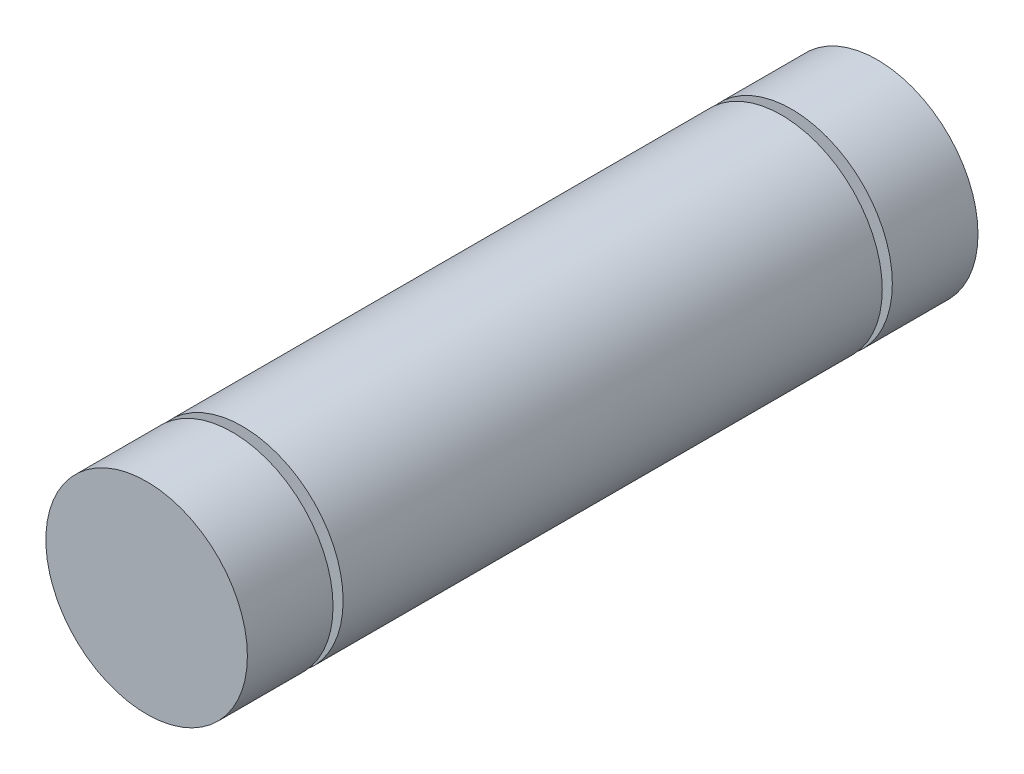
SolidWorks part; units mm, degrees
ref_plane "Plan de face" through (0, 0, 0) normal (0, 0, 1) x (1, 0, 0)
ref_plane "Plan de dessus" through (0, 0, 0) normal (0, 1, 0) x (1, 0, 0)
ref_plane "Plan de droite" through (0, 0, 0) normal (1, 0, 0) x (0, 0, -1)
sketch "Esquisse1" plane through (0, 0, 0) normal (0, 0, 1) x (1, 0, 0)
  circle A0 centre (0, 0) radius 20
  dimension "D1" = 40
extrude "Boss.-Extru.1" add sketch "Esquisse1" along normal blind 145
sketch "Esquisse2" plane through (0, 0, 0) normal (0, 1, 0) x (1, 0, 0)
  line L0 (20, -145) -> (20, 0) construction
  line L1 (20, -19) -> (17, -19)
  line L2 (20, -19) -> (20, -17)
  line L3 (20, -17) -> (17, -17)
  line L4 (17, -19) -> (17, -17)
  line L6 (20, -126) -> (17, -126)
  line L7 (20, -126) -> (20, -128)
  line L8 (20, -128) -> (17, -128)
  line L9 (17, -126) -> (17, -128)
  line L12 (0, -144.188) -> (0, 0) construction
  line L13 (-20, -145) -> (20, -145) construction
  line L14 (20, 0) -> (-20, 0) construction
  dimension "D1" = 19
  dimension "D2" = 3
  dimension "D3" = 19
  dimension "D5" = 2
revolve "Enlèvement de matière-Révolution2" cut sketch "Esquisse2" angle 360 about L12
